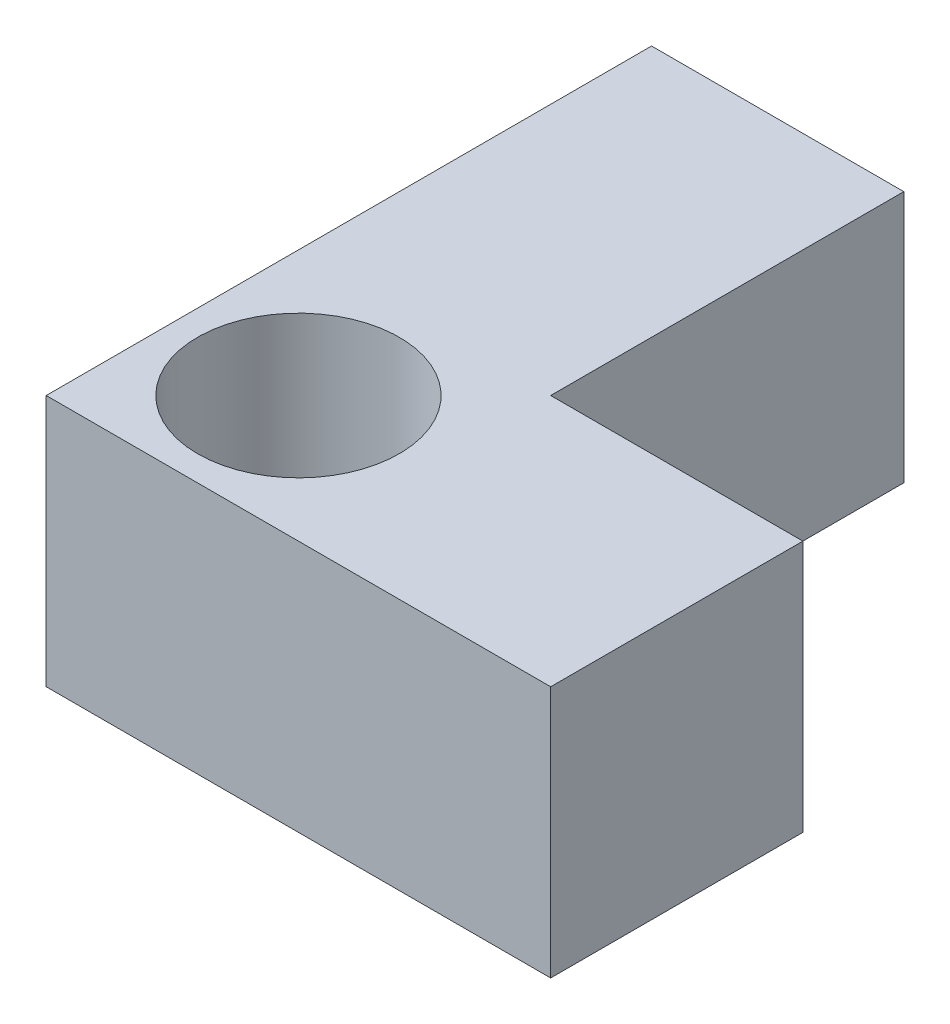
SolidWorks part; units mm, degrees
ref_plane "Front Plane" through (0, 0, 0) normal (0, 0, 1) x (1, 0, 0)
ref_plane "Top Plane" through (0, 0, 0) normal (0, 1, 0) x (1, 0, 0)
ref_plane "Right Plane" through (0, 0, 0) normal (1, 0, 0) x (0, 0, -1)
sketch "Sketch1" plane through (0, 0, 0) normal (0, 1, 0) x (1, 0, 0)
  line L0 (0, 0) -> (0, 120)
  line L1 (0, 120) -> (50, 120)
  line L2 (50, 120) -> (50, 50)
  line L3 (50, 50) -> (100, 50)
  line L4 (100, 50) -> (100, 0)
  line L5 (100, 0) -> (0, 0)
  dimension "D1" = 50
  dimension "D2" = 120
  dimension "D3" = 70
  dimension "D4" = 100
extrude "Boss-Extrude1" add sketch "Sketch1" along normal blind 50
sketch "Sketch2" plane through (0, 0, 0) normal (0, 1, 0) x (1, 0, 0)
  line L0 (0, 0) -> (25, 0)
  line L1 (0, 0) -> (100, 0) construction
  line L2 (0, 0) -> (0, 25)
  line L3 (0, 120) -> (0, 0) construction
  circle A0 centre (25, 25) radius 20
extrude "Cut-Extrude1" cut sketch "Sketch2" along normal blind 50 contours A0
